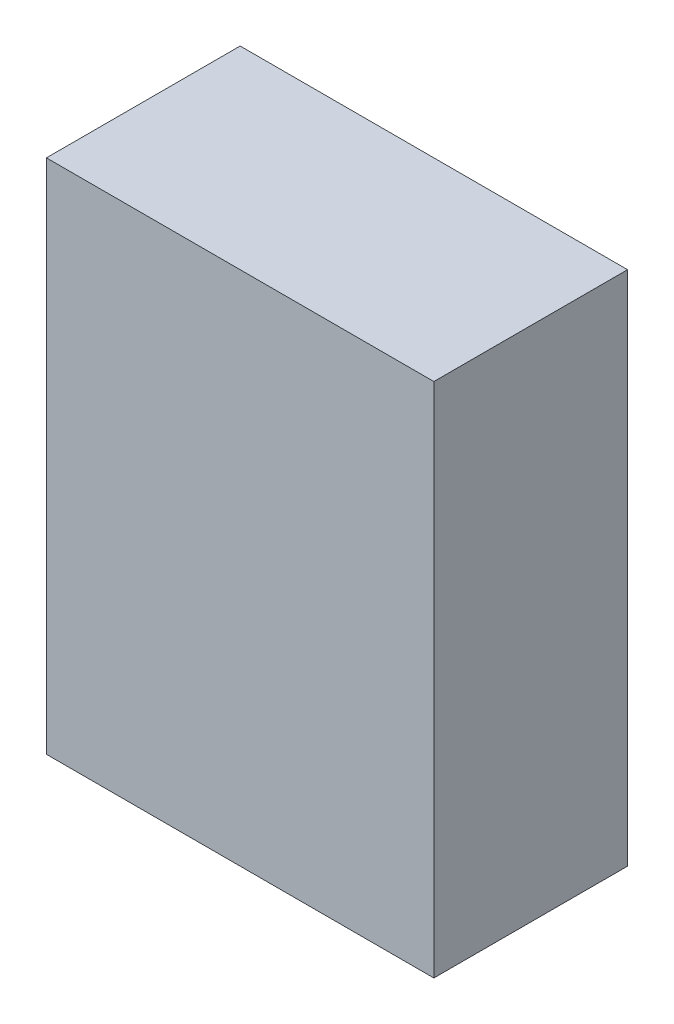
SolidWorks part; units mm, degrees
ref_plane "Front" through (0, 0, 0) normal (0, 0, 1) x (1, 0, 0)
ref_plane "Top" through (0, 0, 0) normal (0, 1, 0) x (1, 0, 0)
ref_plane "Right" through (0, 0, 0) normal (1, 0, 0) x (0, 0, -1)
sketch "Sketch1" plane through (0, 0, 0) normal (0, 0, 1) x (1, 0, 0)
  line L1 (0, 0) -> (76.2, 0)
  line L2 (0, 0) -> (0, 101.6)
  line L3 (0, 101.6) -> (76.2, 101.6)
  line L4 (76.2, 0) -> (76.2, 101.6)
  dimension "D1" = 76.2
  dimension "D2" = 101.6
extrude "Extrude1" add sketch "Sketch1" along normal blind 38.1
